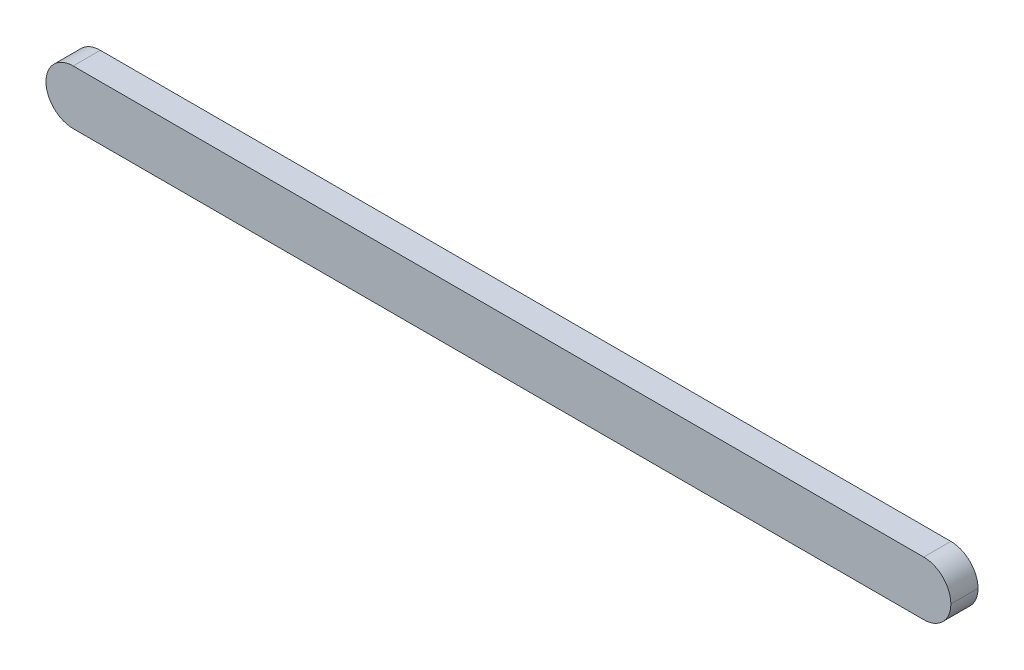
SolidWorks part; units mm, degrees
ref_plane "Front" through (0, 0, 0) normal (0, 0, 1) x (1, 0, 0)
ref_plane "Top" through (0, 0, 0) normal (0, 1, 0) x (1, 0, 0)
ref_plane "Right" through (0, 0, 0) normal (1, 0, 0) x (0, 0, -1)
sketch "Sketch1" plane through (0, 0, 0) normal (0, 0, 1) x (1, 0, 0)
  line L1 (0, 0) -> (100, 0)
  line L2 (0, 0) -> (0, 6)
  line L3 (0, 6) -> (100, 6)
  line L4 (100, 0) -> (100, 6)
  dimension "D1" = 100
  dimension "D2" = 6
extrude "Extrude1" add sketch "Sketch1" along normal blind 3
fillet "Fillet3" radius 3 4 edges at (100, 0, 1.5) (100, 6, 1.5) (0, 6, 1.5) (0, 0, 1.5)
